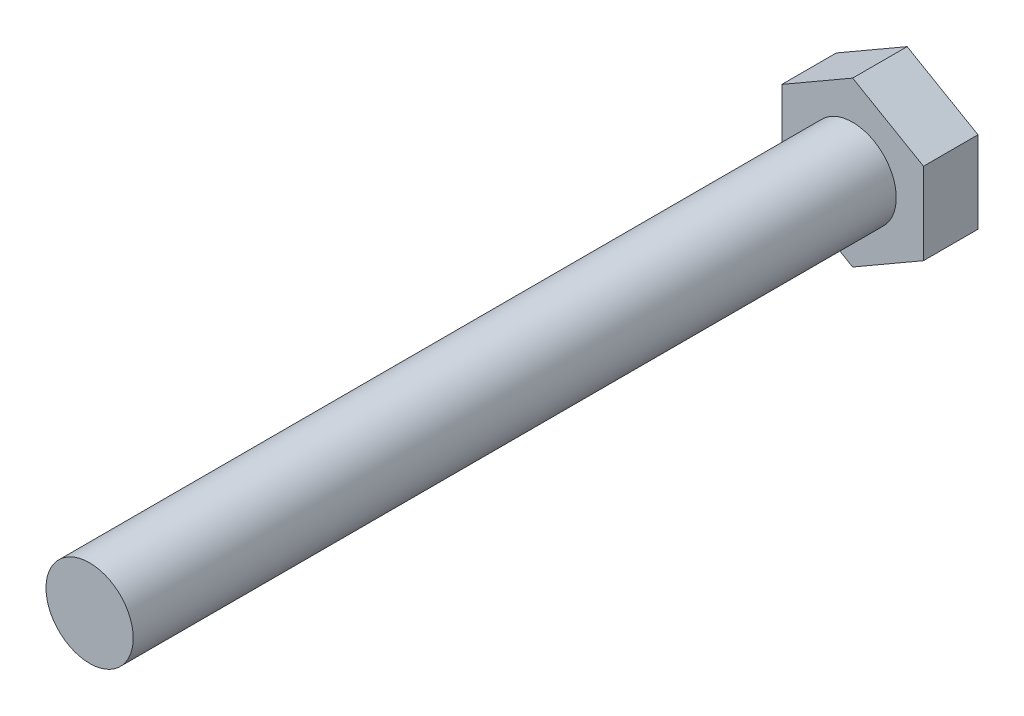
SolidWorks part; units mm, degrees
ref_plane "Front Plane" through (0, 0, 0) normal (0, 0, 1) x (1, 0, 0)
ref_plane "Top Plane" through (0, 0, 0) normal (0, 1, 0) x (1, 0, 0)
ref_plane "Right Plane" through (0, 0, 0) normal (1, 0, 0) x (0, 0, -1)
sketch "Sketch1" plane through (0, 0, 0) normal (0, 0, 1) x (1, 0, 0)
  circle A0 centre (0, 0) radius 4
  dimension "D1" = 8
extrude "Extrude1" add sketch "Sketch1" along normal blind 70
sketch "Sketch2" plane through (0, 0, 0) normal (0, 0, -1) x (-1, 0, 0)
  line L1 (0, -7.5056) -> (6.5, -3.7528)
  line L2 (6.5, -3.7528) -> (6.5, 3.7528)
  line L3 (6.5, 3.7528) -> (0, 7.5056)
  line L4 (0, 7.5056) -> (-6.5, 3.7528)
  line L5 (-6.5, 3.7528) -> (-6.5, -3.7528)
  line L6 (-6.5, -3.7528) -> (0, -7.5056)
  circle A0 centre (0, 0) radius 6.5 construction
  dimension "D1" = 13
extrude "Extrude2" add sketch "Sketch2" along normal blind 5
